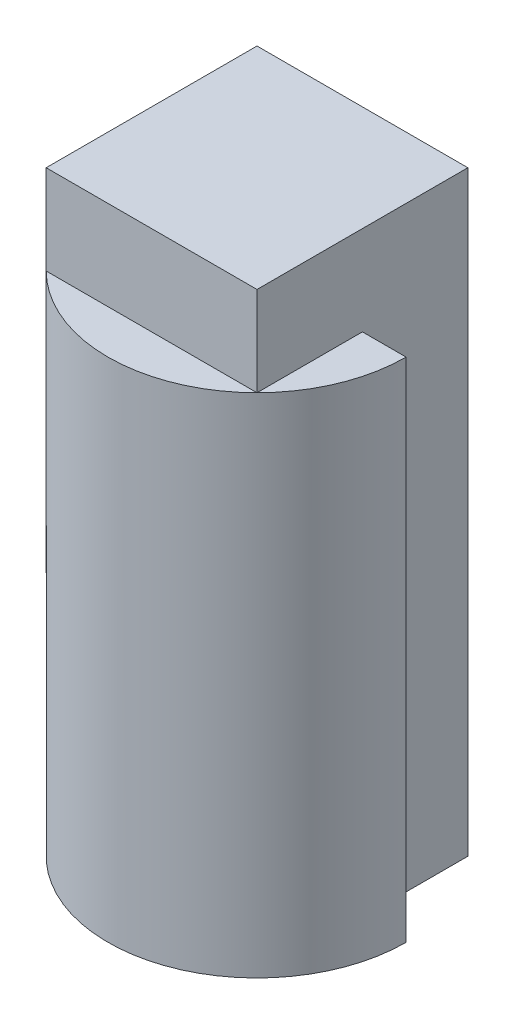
SolidWorks part; units mm, degrees
ref_plane "Ebene vorne" through (0, 0, 0) normal (0, 0, 1) x (1, 0, 0)
ref_plane "Ebene oben" through (0, 0, 0) normal (0, 1, 0) x (1, 0, 0)
ref_plane "Ebene rechts" through (0, 0, 0) normal (1, 0, 0) x (0, 0, -1)
sketch "Skizze1" plane through (0, 0, 0) normal (0, 1, 0) x (1, 0, 0)
  circle A0 centre (0, 0) radius 50
  dimension "D1" = 100
extrude "Aufsatz-Linear austragen1" add sketch "Skizze1" along normal blind 200
sketch "Skizze2" plane through (0, 0, 0) normal (0, -1, 0) x (1, 0, 0)
  circle A0 centre (0, 0) radius 4
  dimension "D1" = 8
extrude "Aufsatz-Linear austragen2" add sketch "Skizze2" along normal blind 10
sketch "Skizze3" plane through (0, 200, 0) normal (0, 1, 0) x (1, 0, 0)
  line L1 (-35.3553, -35.3553) -> (35.3553, -35.3553)
  line L2 (-35.3553, -35.3553) -> (-35.3553, 35.3553)
  line L3 (-35.3553, 35.3553) -> (35.3553, 35.3553)
  line L4 (35.3553, -35.3553) -> (35.3553, 35.3553)
  circle A0 centre (0, 0) radius 50 construction
  circle A1 centre (0, 0) radius 71.4446
extrude "Schnitt-Linear austragen1" cut sketch "Skizze3" against normal blind 30
sketch "Skizze4" plane through (0, 170, 0) normal (0, 1, 0) x (1, 0, 0)
  line L0 (35.3553, -35.3553) -> (35.3553, 35.3553) construction
  line L1 (35.3553, 0) -> (134.2405, 0)
  line L2 (35.3553, 0) -> (35.3553, 35.3553)
  line L3 (35.3553, 35.3553) -> (134.2405, 35.3553)
  line L4 (134.2405, 0) -> (134.2405, 35.3553)
extrude "Schnitt-Linear austragen2" cut sketch "Skizze4" against normal through all
